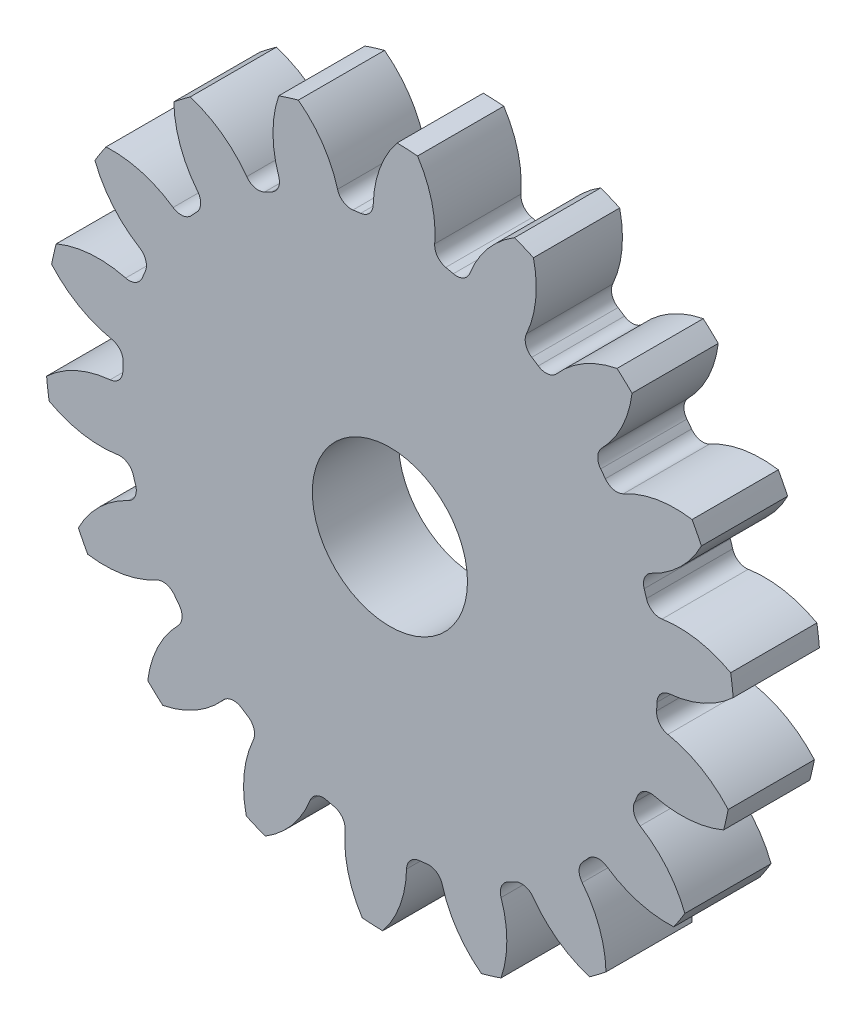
SolidWorks part; units mm, degrees
ref_plane "Front" through (0, 0, 0) normal (0, 0, 1) x (1, 0, 0)
ref_plane "Top" through (0, 0, 0) normal (0, 1, 0) x (1, 0, 0)
ref_plane "Right" through (0, 0, 0) normal (1, 0, 0) x (0, 0, -1)
sketch "Sketch3" plane through (0, 0, 0) normal (0, 0, 1) x (1, 0, 0)
  circle A0 centre (0, 0) radius 508
  dimension "od" = 1016
extrude "gearBody" add sketch "Sketch3" along normal blind 127
sketch "Sketch2" plane through (0, 0, 0) normal (0, 0, 1) x (1, 0, 0)
  line L0 (0, 0) -> (396.924, 164.4113) construction
  line L1 (500.3537, -101.0057) -> (0, 0) construction
  line L2 (0, 0) -> (36.3143, 0) construction
  line L3 (456.8987, 16.5962) -> (452.8819, -62.6885) construction
  line L5 (454.8903, -23.0461) -> (0, 0) construction
  line L7 (0, 0) -> (429.6275, 0) construction
  arc A0 (429.548, 8.2642) -> (426.5133, -51.6348) centre (0, 0) ccw construction
  arc A1 (505.7483, 47.7771) -> (498.33, -98.6468) centre (0, 0) ccw construction
  arc A2 (456.8987, 16.5962) -> (452.8819, -62.6885) centre (0, 0) ccw construction
  arc A3 (392.8654, -25.6212) -> (393.4433, -14.2156) centre (0, 0) ccw
  arc A4 (500.3537, -101.0057) -> (409.4558, -47.2435) centre (378.2751, -203.6852) ccw
  arc A5 (500.3537, -101.0057) -> (508, 49.9195) centre (0, 0) ccw
  arc A6 (508, 49.9195) -> (412.134, 5.6193) centre (396.924, 164.4113) cw
  arc A7 (393.4433, -14.2156) -> (412.134, 5.6193) centre (414.1054, -14.9621) cw
  arc A8 (409.4558, -47.2435) -> (392.8654, -25.6212) centre (413.4972, -26.9667) cw
  point P6 (508, 49.9195)
  point P22 (500.3537, -101.0057)
  dimension "baseDia" = 859.2549
  dimension "od" = 1016
  dimension "pd" = 914.4
  dimension "rd" = 787.4
  dimension "rFillet" = 20.6756
  dimension "pointX" = 508
  dimension "pointY" = 49.9195
  dimension "CTT" = 79.2847
  dimension "flankCenterAngle" = 22.5
extrude "toothCut" cut sketch "Sketch2" along normal through all
pattern_circular "CirPattern1" count 18 over 360 about axis through (0, 0, 0) along (0, 0, 1) of "toothCut"
sketch "hub1Dia" plane through (0, 0, 0) normal (0, 0, -1) x (-1, 0, 0)
  circle A0 centre (0, 0) radius 12.7
  dimension "hub1Dia" = 25.4
sketch "hub2Dia" plane through (0, 0, 127) normal (0, 0, 1) x (1, 0, 0)
  circle A0 centre (0, 0) radius 12.7
  dimension "hub2dia" = 25.4
sketch "boreDia" plane through (0, 0, 0) normal (0, 0, 1) x (1, 0, 0)
  circle A0 centre (0, 0) radius 114.3
  dimension "boreDia" = 228.6
extrude "bore" cut sketch "boreDia" against normal mid plane 25400
